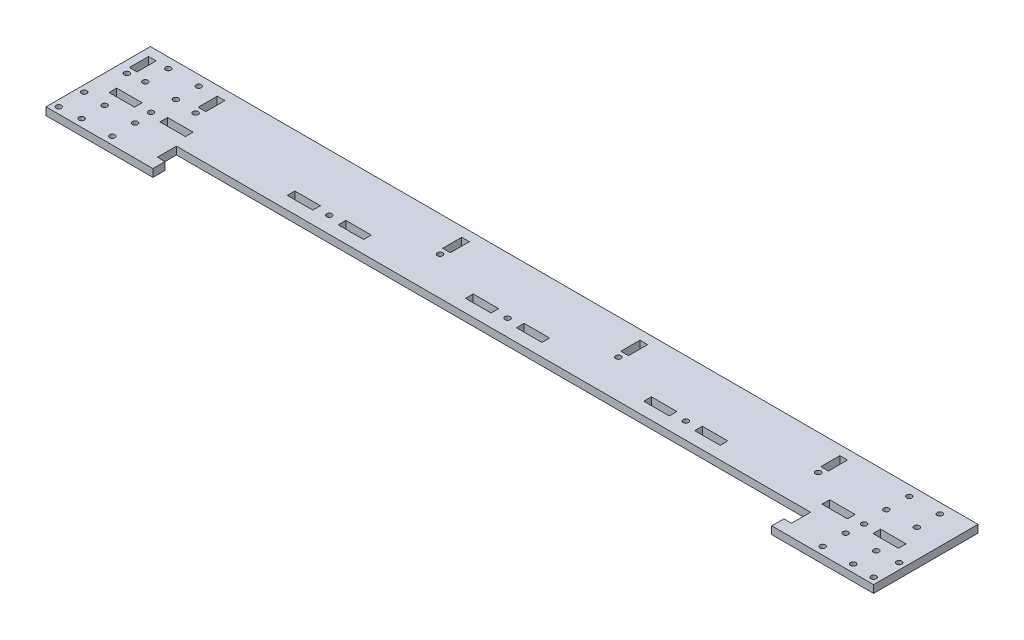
SolidWorks part; units mm, degrees
ref_plane "Спереди" through (0, 0, 0) normal (0, 0, 1) x (1, 0, 0)
ref_plane "Сверху" through (0, 0, 0) normal (0, 1, 0) x (1, 0, 0)
ref_plane "Справа" through (0, 0, 0) normal (1, 0, 0) x (0, 0, -1)
sketch "Эскиз1" plane through (0, 0, 0) normal (0, 1, 0) x (1, 0, 0)
  line L0 (325, 75) -> (325, 111.304) construction
  line L1 (0, 0) -> (650, 0)
  line L2 (0, 0) -> (0, 75)
  line L3 (0, 75) -> (650, 75)
  line L4 (650, 0) -> (650, 75)
  line L5 (15, 40.5) -> (35, 40.5)
  line L6 (15, 40.5) -> (15, 34.5)
  line L7 (15, 34.5) -> (35, 34.5)
  line L8 (35, 40.5) -> (35, 34.5)
  line L9 (55, 34.5) -> (75, 34.5)
  line L10 (55, 34.5) -> (55, 40.5)
  line L11 (55, 40.5) -> (75, 40.5)
  line L12 (75, 34.5) -> (75, 40.5)
  line L13 (155, 40.5) -> (175, 40.5)
  line L14 (155, 40.5) -> (155, 34.5)
  line L15 (155, 34.5) -> (175, 34.5)
  line L16 (175, 40.5) -> (175, 34.5)
  line L17 (195, 40.5) -> (215, 40.5)
  line L18 (195, 40.5) -> (195, 34.5)
  line L19 (195, 34.5) -> (215, 34.5)
  line L20 (215, 40.5) -> (215, 34.5)
  line L21 (295, 40.5) -> (315, 40.5)
  line L22 (295, 40.5) -> (295, 34.5)
  line L23 (295, 34.5) -> (315, 34.5)
  line L24 (315, 40.5) -> (315, 34.5)
  line L25 (335, 40.5) -> (335, 34.5)
  line L26 (355, 34.5) -> (335, 34.5)
  line L27 (355, 40.5) -> (355, 34.5)
  line L28 (355, 40.5) -> (335, 40.5)
  line L29 (435, 40.5) -> (435, 34.5)
  line L30 (455, 34.5) -> (435, 34.5)
  line L31 (455, 40.5) -> (455, 34.5)
  line L32 (455, 40.5) -> (435, 40.5)
  line L33 (475, 40.5) -> (475, 34.5)
  line L34 (495, 34.5) -> (475, 34.5)
  line L35 (495, 40.5) -> (495, 34.5)
  line L36 (495, 40.5) -> (475, 40.5)
  line L37 (575, 34.5) -> (575, 40.5)
  line L38 (595, 40.5) -> (575, 40.5)
  line L39 (595, 34.5) -> (595, 40.5)
  line L40 (595, 34.5) -> (575, 34.5)
  line L41 (615, 40.5) -> (615, 34.5)
  line L42 (635, 34.5) -> (615, 34.5)
  line L43 (635, 40.5) -> (635, 34.5)
  line L44 (635, 40.5) -> (615, 40.5)
  circle A0 centre (45, 37.5) radius 2.1
  circle A1 centre (185, 37.5) radius 2.1
  circle A2 centre (325, 37.5) radius 2.1
  circle A3 centre (465, 37.5) radius 2.1
  circle A4 centre (605, 37.5) radius 2.1
  point P33 (315, 37.5)
  point P34 (215, 37.5)
  point P35 (175, 37.5)
  point P36 (55, 37.5)
  point P37 (35, 37.5)
  point P62 (615, 37.5)
  point P63 (595, 37.5)
  point P64 (475, 37.5)
  point P65 (435, 37.5)
  point P66 (335, 37.5)
extrude "Бобышка-Вытянуть1" add sketch "Эскиз1" along normal blind 6
sketch "Эскиз2" plane through (0, 6, 0) normal (0, 1, 0) x (1, 0, 0)
  line L0 (0, 0) -> (650, 0) construction
  line L2 (84, 0) -> (570, 0)
  line L3 (84, 0) -> (84, 24.5)
  line L4 (84, 24.5) -> (570, 24.5)
  line L5 (570, 0) -> (570, 24.5)
  point P0 (84, 0)
  point P1 (570, 0)
  dimension "D1" = 80
  dimension "D2" = 84
  dimension "D3" = 24.5
extrude "Вырез-Вытянуть1" cut sketch "Эскиз2" against normal through all
sketch "Эскиз3" plane through (0, 6, 0) normal (0, 1, 0) x (1, 0, 0)
  line L0 (84, 24.5) -> (84, 0) construction
  line L1 (84, 9.5) -> (78, 9.5)
  line L2 (84, 9.5) -> (84, 24.5)
  line L3 (84, 24.5) -> (78, 24.5)
  line L4 (78, 9.5) -> (78, 24.5)
  line L5 (0, 0) -> (84, 0) construction
  line L6 (570, 0) -> (570, 24.5) construction
  line L7 (570, 9.5) -> (576, 9.5)
  line L8 (570, 9.5) -> (570, 24.5)
  line L9 (570, 24.5) -> (576, 24.5)
  line L10 (576, 9.5) -> (576, 24.5)
  line L11 (570, 0) -> (650, 0) construction
  dimension "D1" = 9.5
  dimension "D2" = 15
  dimension "D3" = 6
  dimension "D4" = 9.5
  dimension "D5" = 6
  dimension "D6" = 15
extrude "Вырез-Вытянуть2" cut sketch "Эскиз3" against normal through all
sketch "Эскиз4" plane through (0, 6, 0) normal (0, 1, 0) x (1, 0, 0)
  line L0 (0, 75) -> (0, 0) construction
  line L1 (6, 74.5) -> (12, 74.5)
  line L2 (6, 74.5) -> (6, 59.5)
  line L3 (6, 59.5) -> (12, 59.5)
  line L4 (12, 74.5) -> (12, 59.5)
  line L5 (60, 74.5) -> (66, 74.5)
  line L6 (60, 74.5) -> (60, 59.5)
  line L7 (60, 59.5) -> (66, 59.5)
  line L8 (66, 74.5) -> (66, 59.5)
  line L9 (252, 74.5) -> (258, 74.5)
  line L10 (252, 74.5) -> (252, 59.5)
  line L11 (252, 59.5) -> (258, 59.5)
  line L12 (258, 74.5) -> (258, 59.5)
  line L17 (392, 74.5) -> (398, 74.5)
  line L18 (392, 74.5) -> (392, 59.5)
  line L19 (392, 59.5) -> (398, 59.5)
  line L20 (398, 74.5) -> (398, 59.5)
  line L21 (549, 74.5) -> (555, 74.5)
  line L22 (549, 74.5) -> (549, 59.5)
  line L23 (549, 59.5) -> (555, 59.5)
  line L24 (555, 74.5) -> (555, 59.5)
  line L25 (650, 75) -> (0, 75) construction
  circle A0 centre (9, 54.5) radius 2.1
  circle A1 centre (63, 54.5) radius 2.1
  circle A2 centre (255, 54.5) radius 2.1
  circle A4 centre (395, 54.5) radius 2.1
  circle A5 centre (552, 54.5) radius 2.1
  point P36 (9, 59.5)
  point P37 (63, 59.5)
  point P38 (255, 59.5)
  point P40 (395, 59.5)
  point P41 (552, 59.5)
  dimension "D1" = 4.2
  dimension "D2" = 15
  dimension "D3" = 6
  dimension "D4" = 6
  dimension "D5" = 6
  dimension "D7" = 6
  dimension "D8" = 6
  dimension "D9" = 5
  dimension "D10" = 6
  dimension "D11" = 48
  dimension "D12" = 0.5
  dimension "D13" = 186
  dimension "D14" = 134
  dimension "D15" = 151
extrude "Вырез-Вытянуть3" cut sketch "Эскиз4" against normal through all
sketch "Эскиз5" plane through (0, 6, 0) normal (0, 1, 0) x (1, 0, 0)
  line L0 (650, 0) -> (650, 75) construction
  line L1 (0, 75) -> (650, 75)
  line L2 (0, 75) -> (0, 82)
  line L3 (0, 82) -> (650, 82)
  line L4 (650, 75) -> (650, 82)
  dimension "D1" = 7
extrude "Бобышка-Вытянуть2" add sketch "Эскиз5" against normal up to surface (6 mm away)
sketch "Эскиз6" plane through (0, 6, 0) normal (0, 1, 0) x (1, 0, 0)
  line L0 (650, 82) -> (0, 82) construction
  line L1 (22, 74) -> (46, 74) construction
  line L2 (22, 74) -> (22, 56) construction
  line L3 (22, 56) -> (46, 56) construction
  line L4 (46, 74) -> (46, 56) construction
  line L5 (22, 24) -> (46, 24) construction
  line L6 (22, 24) -> (22, 6) construction
  line L7 (22, 6) -> (46, 6) construction
  line L8 (46, 24) -> (46, 6) construction
  line L9 (0, 0) -> (84, 0) construction
  line L12 (12, 59.5) -> (12, 74.5) construction
  line L13 (325, 82) -> (325, 149.892) construction
  line L14 (604, 24) -> (604, 6) construction
  line L15 (628, 6) -> (604, 6) construction
  line L16 (628, 24) -> (628, 6) construction
  line L17 (628, 24) -> (604, 24) construction
  line L18 (604, 74) -> (604, 56) construction
  line L19 (628, 56) -> (604, 56) construction
  line L20 (628, 74) -> (628, 56) construction
  line L21 (628, 74) -> (604, 74) construction
  circle A0 centre (22, 74) radius 2.1
  circle A1 centre (46, 74) radius 2.1
  circle A2 centre (46, 56) radius 2.1
  circle A3 centre (22, 56) radius 2.1
  circle A4 centre (22, 24) radius 2.1
  circle A5 centre (46, 24) radius 2.1
  circle A6 centre (46, 6) radius 2.1
  circle A7 centre (22, 6) radius 2.1
  circle A8 centre (628, 6) radius 2.1
  circle A9 centre (604, 6) radius 2.1
  circle A10 centre (604, 24) radius 2.1
  circle A11 centre (628, 24) radius 2.1
  circle A12 centre (628, 56) radius 2.1
  circle A13 centre (604, 56) radius 2.1
  circle A14 centre (604, 74) radius 2.1
  circle A15 centre (628, 74) radius 2.1
  point P8 (34, 56)
  point P9 (34, 24)
  point P42 (616, 24)
  point P43 (616, 56)
  dimension "D8" = 4.2
  dimension "D1" = 24
  dimension "D2" = 18
  dimension "D3" = 18
  dimension "D4" = 24
  dimension "D5" = 8
  dimension "D6" = 6
  dimension "D7" = 10
extrude "Вырез-Вытянуть4" cut sketch "Эскиз6" against normal through all
sketch "Эскиз7" plane through (0, 6, 0) normal (0, 1, 0) x (1, 0, 0)
  line L0 (0, 82) -> (0, 0) construction
  line L1 (0, 0) -> (84, 0) construction
  line L2 (325, 82) -> (325, 113.7846) construction
  line L3 (650, 82) -> (0, 82) construction
  circle A0 centre (5, 25) radius 2.1
  circle A1 centre (5, 5) radius 2.1
  circle A2 centre (645, 5) radius 2.1
  circle A3 centre (645, 25) radius 2.1
  dimension "D1" = 4.2
  dimension "D2" = 5
  dimension "D3" = 20
  dimension "D4" = 5
extrude "Вырез-Вытянуть5" cut sketch "Эскиз7" against normal through all
equation "\"D14@Эскиз1\"=\"D11@Эскиз1\"/2"
equation "\"D18@Эскиз1\"=\"D16@Эскиз1\"/2"
equation "\"D22@Эскиз1\"=\"D21@Эскиз1\"/2"
equation "\"D7@Эскиз1\"=\"D2@Эскиз1\"/2"
